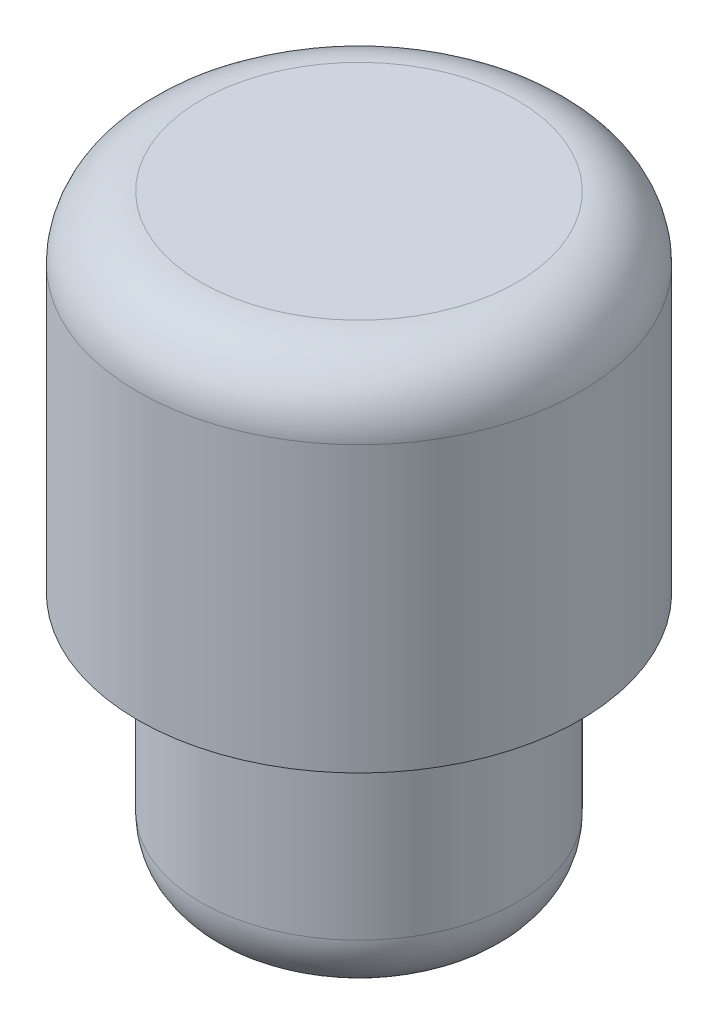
SolidWorks part; units mm, degrees
ref_plane "Front" through (0, 0, 0) normal (0, 0, 1) x (1, 0, 0)
ref_plane "Top" through (0, 0, 0) normal (0, 1, 0) x (1, 0, 0)
ref_plane "Right" through (0, 0, 0) normal (1, 0, 0) x (0, 0, -1)
sketch "Esquisse1" plane through (0, 0, 0) normal (0, 1, 0) x (1, 0, 0)
  circle A0 centre (0, 0) radius 3.5
  dimension "D1" = 7
extrude "Boss.-Extru.1" add sketch "Esquisse1" along normal blind 5.5
fillet "Congé1" radius 1 1 edges at (0, 5.5, 3.5)
sketch "Esquisse2" plane through (0, 0, 0) normal (0, -1, 0) x (1, 0, 0)
  circle A0 centre (0, 0) radius 2.5
  dimension "D1" = 5
extrude "Boss.-Extru.2" add sketch "Esquisse2" along normal blind 4
fillet "Congé2" radius 1 1 edges at (0, -4, -2.5)
